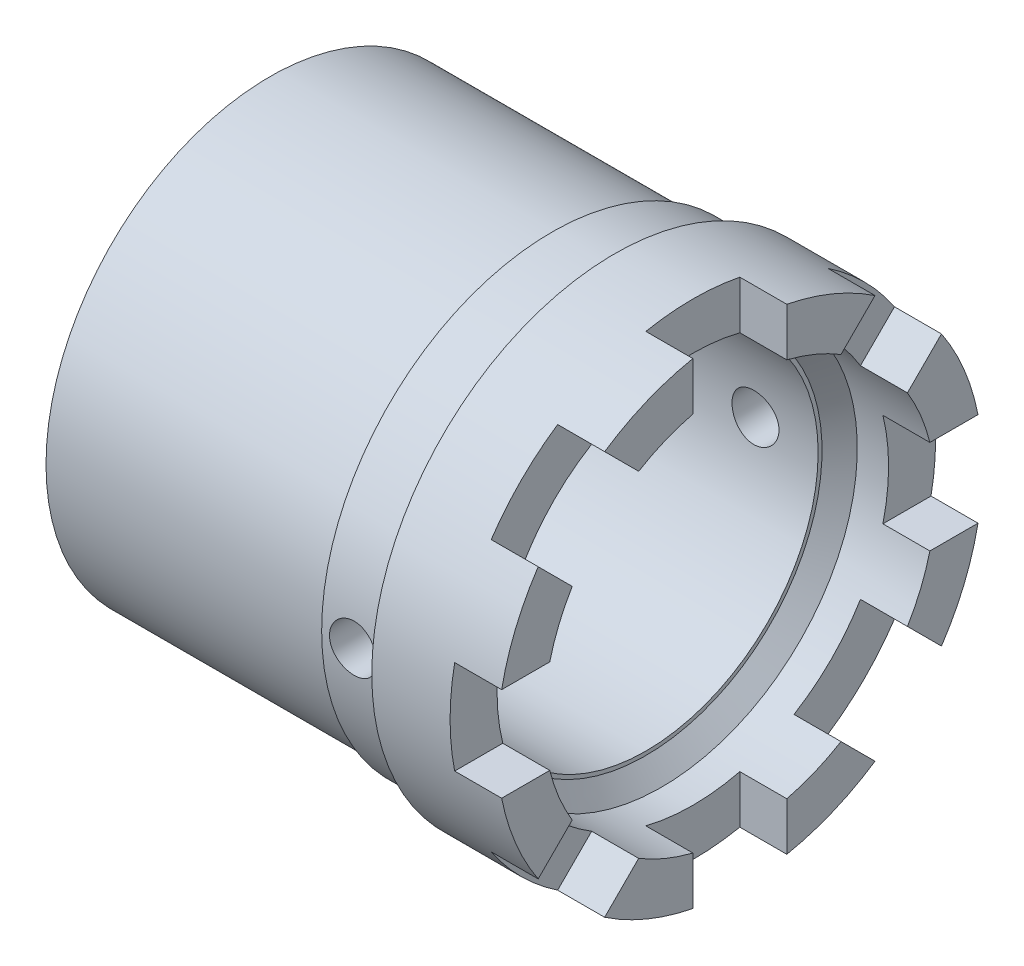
SolidWorks part; units mm, degrees
ref_plane "Plane1" through (0, 0, 0) normal (0, 0, 1) x (1, 0, 0)
ref_plane "Plane2" through (0, 0, 0) normal (0, 1, 0) x (1, 0, 0)
ref_plane "Plane3" through (0, 0, 0) normal (1, 0, 0) x (0, 0, -1)
sketch "Esquisse1" plane through (0, 0, 0) normal (0, 0, 1) x (1, 0, 0)
  line L0 (-24, 11) -> (0, 11)
  line L1 (0, 11.25) -> (1, 12.5)
  line L2 (0, 11) -> (0, 11.25)
  line L3 (6, 15.5) -> (-2, 15.5)
  line L4 (-2, 15.5) -> (-2.5, 14.7)
  line L5 (-2.5, 14.7) -> (-6, 14.7)
  line L6 (-6, 14.7) -> (-6, 14.3)
  line L7 (-6, 14.3) -> (-24, 14.3)
  line L8 (-24, 14.3) -> (-24, 11)
  line L9 (0, 0) -> (29, 0) construction
  line L10 (1, 12.5) -> (6, 12.5)
  line L11 (6, 12.5) -> (6, 15.5)
  dimension "D1" = 11
  dimension "D2" = 15.5
  dimension "D3" = 12.5
  dimension "D4" = 8
  dimension "D5" = 14.3
  dimension "D6" = 14.7
  dimension "D7" = 6
  dimension "D10" = 3.5
  dimension "D11" = 30
revolve "Base-Révolution" add sketch "Esquisse1" angle 360 about L9
sketch "Esquisse2" plane through (6, 0, 0) normal (1, 0, 0) x (0, 0, -1)
  line L0 (-3, 10) -> (3, 10)
  line L1 (-3, 10) -> (-3, 17)
  line L2 (3, 17) -> (-3, 17)
  line L3 (3, 17) -> (3, 10)
extrude "Enlèv. mat.-Extru.1" cut sketch "Esquisse2" against normal blind 3
pattern_circular "Répétition circulaire1" count 8 every 45 about axis through (0, 0, 0) along (1, 0, 0)
ref_plane "Plan4" through (0, 0, 25) normal (0, 0, 1) x (1, 0, 0)
sketch "Esquisse3" plane through (0, 0, 25) normal (0, 0, 1) x (1, 0, 0)
  line L0 (-24, 14.3) -> (-24, -14.3) construction
  circle A0 centre (-4, 0) radius 1.5
  dimension "D1" = 3
  dimension "D2" = 20
extrude "Enlèv. mat.-Extru.2" cut sketch "Esquisse3" against normal through all
